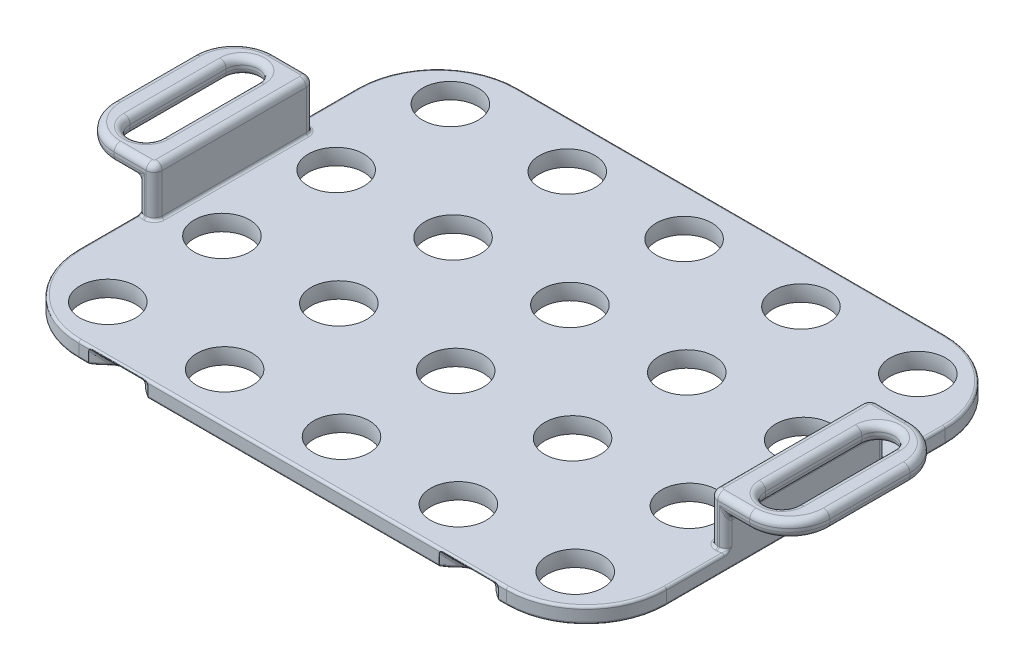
SolidWorks part; units mm, degrees
ref_plane "Ebene vorne" through (0, 0, 0) normal (0, 0, 1) x (1, 0, 0)
ref_plane "Ebene oben" through (0, 0, 0) normal (0, 1, 0) x (1, 0, 0)
ref_plane "Ebene rechts" through (0, 0, 0) normal (1, 0, 0) x (0, 0, -1)
sketch "Skizze1" plane through (0, 0, 0) normal (0, 1, 0) x (1, 0, 0)
  line L1 (-183.5, -137) -> (183.5, -137)
  line L2 (-183.5, -137) -> (-183.5, 137)
  line L3 (-183.5, 137) -> (183.5, 137)
  line L4 (183.5, -137) -> (183.5, 137)
  line L5 (-183.5, -137) -> (183.5, 137) construction
  line L6 (-183.5, 137) -> (183.5, -137) construction
  point P0 (0, 0)
  dimension "D1" = 367
  dimension "D2" = 274
extrude "Aufsatz-Linear austragen1" add sketch "Skizze1" along normal blind 10
sketch "Skizze2" plane through (0, 10, 0) normal (0, 1, 0) x (1, 0, 0)
  line L0 (0, 137) -> (0, -137) construction
  line L1 (183.5, 137) -> (-183.5, 137) construction
  line L2 (-183.5, -137) -> (183.5, -137) construction
  line L3 (-183.5, 0) -> (183.5, 0) construction
  line L4 (-183.5, 137) -> (-183.5, -137) construction
  line L5 (183.5, -137) -> (183.5, 137) construction
  line L6 (173.5, 50) -> (183.5, -50) construction
  line L7 (-173.5, -50) -> (-183.5, -50)
  line L8 (-173.5, -50) -> (-173.5, 50)
  line L9 (-173.5, 50) -> (-183.5, 50)
  line L10 (-183.5, -50) -> (-183.5, 50)
  line L11 (-173.5, -50) -> (-183.5, 50) construction
  line L12 (-173.5, 50) -> (-183.5, -50) construction
  line L13 (173.5, -50) -> (183.5, 50) construction
  line L14 (183.5, -50) -> (183.5, 50)
  line L15 (173.5, 50) -> (183.5, 50)
  line L16 (173.5, -50) -> (173.5, 50)
  line L17 (173.5, -50) -> (183.5, -50)
  point P12 (-178.5, 0)
  point P21 (178.5, 0)
  dimension "D1" = 10
  dimension "D2" = 100
extrude "Aufsatz-Linear austragen2" add sketch "Skizze2" along normal blind 20
sketch "Skizze3" plane through (0, 30, 0) normal (0, 1, 0) x (1, 0, 0)
  line L0 (-183.5, -50) -> (-173.5, -50) construction
  line L1 (-173.5, 50) -> (-223.5, 50)
  line L2 (-173.5, 50) -> (-173.5, -50)
  line L3 (-173.5, -50) -> (-223.5, -50)
  line L4 (-223.5, 50) -> (-223.5, -50)
  line L5 (0, 137) -> (0, -137) construction
  line L6 (183.5, 137) -> (-183.5, 137) construction
  line L7 (-183.5, -137) -> (183.5, -137) construction
  line L8 (223.5, 50) -> (223.5, -50)
  line L9 (173.5, -50) -> (223.5, -50)
  line L10 (173.5, 50) -> (173.5, -50)
  line L11 (173.5, 50) -> (223.5, 50)
  dimension "D1" = 50
extrude "Aufsatz-Linear austragen3" add sketch "Skizze3" along normal blind 10
sketch "Skizze4" plane through (0, 0, 0) normal (0, -1, 0) x (-1, 0, 0)
  circle A0 centre (145.5, -107) radius 15
  circle A1 centre (72.5, -107) radius 15
  circle A2 centre (-0.5, -107) radius 15
  circle A3 centre (-73.5, -107) radius 15
  circle A4 centre (-146.5, -107) radius 15
  circle A5 centre (145.5, -35.6667) radius 15
  circle A6 centre (72.5, -35.6667) radius 15
  circle A7 centre (-0.5, -35.6667) radius 15
  circle A8 centre (-73.5, -35.6667) radius 15
  circle A9 centre (-146.5, -35.6667) radius 15
  circle A10 centre (145.5, 35.6667) radius 15
  circle A11 centre (72.5, 35.6667) radius 15
  circle A12 centre (-0.5, 35.6667) radius 15
  circle A13 centre (-73.5, 35.6667) radius 15
  circle A14 centre (-146.5, 35.6667) radius 15
  circle A15 centre (145.5, 107) radius 15
  circle A16 centre (72.5, 107) radius 15
  circle A17 centre (-0.5, 107) radius 15
  circle A18 centre (-73.5, 107) radius 15
  circle A19 centre (-146.5, 107) radius 15
  dimension "D1" = 30
  dimension "D2" = 72.5
  dimension "D3" = 145.5
  dimension "D4" = 0.5
  dimension "D5" = 73.5
  dimension "D6" = 146.5
  dimension "D7" = 35.6667
  dimension "D8" = 107
  dimension "D9" = 35.6667
  dimension "D10" = 107
extrude "Schnitt-Linear austragen1" cut sketch "Skizze4" against normal through all
fillet "Verrundung1" radius 50 4 edges at (-183.5, 5, -137) (183.5, 5, -137) (183.5, 5, 137) (-183.5, 5, 137)
fillet "Verrundung6" radius 25 4 edges at (-223.5, 35, -50) (-223.5, 35, 50) (223.5, 35, -50) (223.5, 35, 50)
other "Formnest2"
other "Kiste<1>@Kiste gefüllt1"
sketch "Skizze5" plane through (0, 40, 0) normal (0, 1, 0) x (1, 0, 0)
  line L0 (-223.5, 0) -> (223.5, 0) construction
  line L1 (-223.5, 25) -> (-223.5, -25) construction
  line L2 (223.5, -25) -> (223.5, 25) construction
  line L3 (-198.5, -30) -> (-198.5, 30) construction
  line L4 (-208.5, -30) -> (-208.5, 30)
  line L5 (-188.5, -30) -> (-188.5, 30)
  line L6 (0, 137) -> (0, -137) construction
  line L7 (133.5, 137) -> (-133.5, 137) construction
  line L8 (-133.5, -137) -> (133.5, -137) construction
  line L9 (198.5, -30) -> (198.5, 30) construction
  line L10 (208.5, -30) -> (208.5, 30)
  line L11 (188.5, -30) -> (188.5, 30)
  arc A0 (-208.5, -30) -> (-188.5, -30) centre (-198.5, -30) ccw
  arc A1 (-188.5, 30) -> (-208.5, 30) centre (-198.5, 30) ccw
  arc A2 (208.5, -30) -> (188.5, -30) centre (198.5, -30) cw
  arc A3 (188.5, 30) -> (208.5, 30) centre (198.5, 30) cw
  point P8 (-198.5, 0)
  point P21 (198.5, 0)
  dimension "D1" = 25
  dimension "D2" = 20
  dimension "D3" = 60
extrude "Schnitt-Linear austragen2" cut sketch "Skizze5" against normal through all
ref_plane "Ebene1" through (0, 0, 107) normal (0, 0, -1) x (-1, 0, 0)
sketch "Skizze6" plane through (0, 0, 107) normal (0, 0, -1) x (-1, 0, 0)
  line L0 (-163.5, 5) -> (-198, 5) construction
  line L1 (119.3381, 0) -> (127.4722, 0) construction
  line L3 (-163.8642, 10) -> (-146.5, 10)
  line L4 (183.5, 10) -> (133.5, 10) construction
  line L6 (-146.5, 10) -> (-146.5, 0)
  line L9 (-146.5, 0) -> (-163.8642, 0)
  line L13 (-146.5, 10) -> (-146.5, 0) construction
  arc A0 (-163.8642, 0) -> (-163.8642, 10) centre (-198, 5) ccw
  dimension "D3" = 69
  dimension "D1" = 5
  dimension "D2" = 17
revolve "Schnitt-Rotation1" cut sketch "Skizze6" angle 360 about L6
ref_plane "Ebene2" through (146.5, 0, 0) normal (1, 0, 0) x (0, 0, -1)
sketch "Skizze7" plane through (146.5, 0, 0) normal (1, 0, 0) x (0, 0, -1)
  line L0 (-107, 0) -> (-107, 10) construction
  line L1 (-50, 10) -> (-87, 10) construction
  line L2 (-124, 5) -> (-159.5, 5) construction
  line L3 (-107, -5.0242) -> (-107, 25.0485) construction
  circle A0 centre (-159.5, 5) radius 35.5
  point P0 (-124, 5)
  dimension "D3" = 71
  dimension "D1" = 17
  dimension "D2" = 5
  dimension "D4" = 52.5
pattern_linear "Lineares Muster2" count 5 spacing 73 along (-1, 0, 0) count 4 spacing 71.3333 along (0, 0, -1) of "Schnitt-Rotation1"
surface "Oberfläche-Linear austragen1" sketch "Skizze7" parameters "D1"=10
ref_plane "Ebene3" through (0.5, 0, 0) normal (1, 0, 0) x (0, 0, -1)
sketch "Skizze8" plane through (0.5, 0, 0) normal (1, 0, 0) x (0, 0, -1)
  line L0 (-137, 5) -> (151.3017, 5) construction
  line L1 (-137, 0) -> (-137, 7.3288) construction
  line L2 (-137, 0) -> (-130.2498, 0) construction
  line L3 (-129.4949, 10) -> (-137, 10)
  line L4 (-87, 10) -> (-137, 10) construction
  line L5 (-137, 10) -> (-137, 0)
  line L6 (-137, 0) -> (-129.4949, 0)
  line L7 (-137, 0) -> (-130.2498, 0) construction
  arc A0 (-129.4949, 10) -> (-129.4949, 0) centre (-105, 5) ccw
  dimension "D2" = 7
  dimension "D3" = 25
  dimension "D1" = 5
extrude "Schnitt-Linear austragen3" [suppressed] cut sketch "Skizze8" against normal mid plane 10
sketch "Skizze9" [suppressed] plane through (0, 0, 0) normal (1, 0, 0) x (0, 0, -1)
  line L0 (-107, 0) -> (107, 0) construction
  line L1 (-138.5, 31.4696) -> (-138.5, 21.4696) construction
  circle A0 centre (-80, 5) radius 50
  dimension "D2" = 100
  dimension "D1" = 5
  dimension "D3" = 58.5
sketch "Skizze10" [suppressed] plane through (0, 0, 0) normal (1, 0, 0) x (0, 0, -1)
  line L0 (-137, 5) -> (-124, 5) construction
  line L1 (-137, 10) -> (-137, 0) construction
  line L2 (-107, -5.0242) -> (-107, 25.0485) construction
  point P6 (-125, 5)
  dimension "D1" = 17
  dimension "D2" = 1
fillet "Verrundung2" radius 5 4 edges at (173.5, 25, -50) (173.5, 25, 50) (-173.5, 25, -50) (-173.5, 25, 50)
fillet "Verrundung3" radius 4 24 edges at (-174.9645, 40, 48.5355) (-188.5, 40, 50) (-223.5, 40, 0) (-188.5, 40, -50) (-174.9645, 40, -48.5355) (-173.5, 40, 0) (-198.5, 40, -40) (-208.5, 40, 0) (-198.5, 40, 40) (-188.5, 40, 0) (223.5, 40, 0) (188.5, 40, 50) (174.9645, 40, 48.5355) (173.5, 40, 0) (174.9645, 40, -48.5355) (188.5, 40, -50) (198.5, 40, -40) (188.5, 40, 0) (198.5, 40, 40) (208.5, 40, 0) (-216.1777, 40, 42.6777) (-216.1777, 40, -42.6777) (216.1777, 40, -42.6777) (216.1777, 40, 42.6777)
fillet "Verrundung4" radius 4 22 edges at (223.5, 30, 0) (198.5, 30, -40) (188.5, 30, 0) (198.5, 30, 40) (-198.5, 30, -40) (-208.5, 30, 0) (-198.5, 30, 40) (208.5, 30, 0) (-188.5, 30, 0) (-223.5, 30, 0) (-216.1777, 30, -42.6777) (-216.1777, 30, 42.6777) (216.1777, 30, -42.6777) (216.1777, 30, 42.6777)
fillet "Verrundung5" radius 4 6 edges at (-182.3284, 31.1716, -48.8284) (-182.3284, 31.1716, 48.8284) (182.3284, 31.1716, 48.8284) (182.3284, 31.1716, -48.8284)
sketch "Skizze11" plane through (0, 0, 0) normal (0, -1, 0) x (-1, 0, 0)
  line L0 (92.8032, -137) -> (125.1968, -137) construction
  line L1 (-126.1968, -137) -> (-93.8032, -137) construction
  line L2 (-126.1968, 137) -> (-93.8032, 137) construction
  line L3 (92.8032, 137) -> (125.1968, 137) construction
  circle A0 centre (109, -137) radius 20
  circle A1 centre (-110, -137) radius 20
  circle A2 centre (-110, 137) radius 20
  circle A3 centre (109, 137) radius 20
  dimension "D1" = 40
extrude "Schnitt-Linear austragen4" [suppressed] cut sketch "Skizze11" against normal through all
fillet "Verrundung7" [suppressed] radius 25
fillet "Verrundung8" radius 1.5 24 edges at (-182.3284, 10, -48.8284) (-182.3284, 10, 48.8284) (-174.9645, 10, 48.5355) (-173.5, 10, 0) (182.3284, 10, 48.8284) (179, 10, 50) (174.9645, 10, 48.5355) (173.5, 10, 0) (182.3284, 10, -48.8284) (179, 10, -50) (-168.8553, 10, 122.3553) (183.5, 10, 66.5) (168.8553, 10, 122.3553) (183.5, 10, -66.5) (168.8553, 10, -122.3553) (-168.8553, 10, -122.3553) (-174.9645, 10, -48.5355) (174.9645, 10, -48.5355) (0, 10, 137) (0, 10, -137)
sketch "Skizze12" plane through (0, 10, 0) normal (0, 1, 0) x (1, 0, 0)
  circle A0 centre (0.5, -107) radius 17
  dimension "D1" = 34
surface "Oberfläche-Linear austragen2" sketch "Skizze12" parameters "D1"=10
fillet "Verrundung9" radius 0.5 52 edges at (91.669, 8.0077, 137) (-127.331, 8.0077, 137) (-90.669, 8.0077, -137) (128.331, 8.0077, -137) (-94.8511, 3.9997, -133.9337) (124.1489, 3.9997, -133.9337) (95.8511, 3.9997, 133.9337) (-123.1489, 3.9997, 133.9337) (128.1893, 8.2448, 137) (-90.8107, 8.2448, 137) (120.8276, 4.8952, 132.8952) (127.1173, 8.8392, 136.9611) (110, 8.9354, 136.9354) (92.405, 8.6984, 136.9868) (-98.1724, 4.8952, 132.8952) (-91.8827, 8.8392, 136.9611) (-109, 8.9354, 136.9354) (-126.595, 8.6984, 136.9868) (91.8107, 8.2448, -137) (-127.1893, 8.2448, -137) (-119.8276, 4.8952, -132.8952) (-126.1173, 8.8392, -136.9611) (-109, 8.9354, -136.9354) (-91.405, 8.6984, -136.9868) (99.1724, 4.8952, -132.8952) (92.8827, 8.8392, -136.9611) (110, 8.9354, -136.9354) (127.595, 8.6984, -136.9868) (-127.4722, 3.6644, -137) (-90.5278, 3.6644, -137) (91.5278, 3.6644, -137) (128.4722, 3.6644, -137) (128.4722, 3.6644, 137) (91.5278, 3.6644, 137) (-90.5278, 3.6644, 137) (-127.4722, 3.6644, 137)
fillet "Verrundung10" radius 1.5 48 edges at (-183.5, 0, 0) (183.5, 0, 0) (-130.5557, 0, 137) (131.0557, 0, -137) (-168.8553, 0, 122.3553) (168.8553, 0, 122.3553) (168.8553, 0, -122.3553) (-168.8553, 0, -122.3553) (-116.5767, 0, -128.2415) (-109, 0, -128) (-100.9528, 0, -128.4445) (-94.905, 0, -133.8889) (102.4233, 0, -128.2415) (110, 0, -128) (118.0472, 0, -128.4445) (124.095, 0, -133.8889) (101.9528, 0, 128.4445) (110, 0, 128) (95.905, 0, 133.8889) (117.5767, 0, 128.2415) (-117.0472, 0, 128.4445) (-109, 0, 128) (-123.095, 0, 133.8889) (-101.4233, 0, 128.2415) (-123.095, 3.951, -133.8889) (95.905, 3.951, -133.8889) (124.095, 3.951, 133.8889) (-94.905, 3.951, 133.8889) (120.6623, 4.7429, -132.7429) (-98.3377, 4.7429, -132.7429) (-119.6623, 4.7429, 132.7429) (99.3377, 4.7429, 132.7429) (95.905, 0, -133.8889) (0.5, 0, -137) (0.5, 0, 137) (-94.905, 0, 133.8889) (-130.5557, 0, -137) (-123.095, 0, -133.8889) (131.0557, 0, 137) (124.095, 0, 133.8889) (-127.4769, 0, 136.9815) (-90.5231, 0, 136.9815) (91.5231, 0, 136.9815) (128.4769, 0, 136.9815) (-90.5231, 0, -136.9815) (-127.4769, 0, -136.9815) (128.4769, 0, -136.9815) (91.5231, 0, -136.9815)
